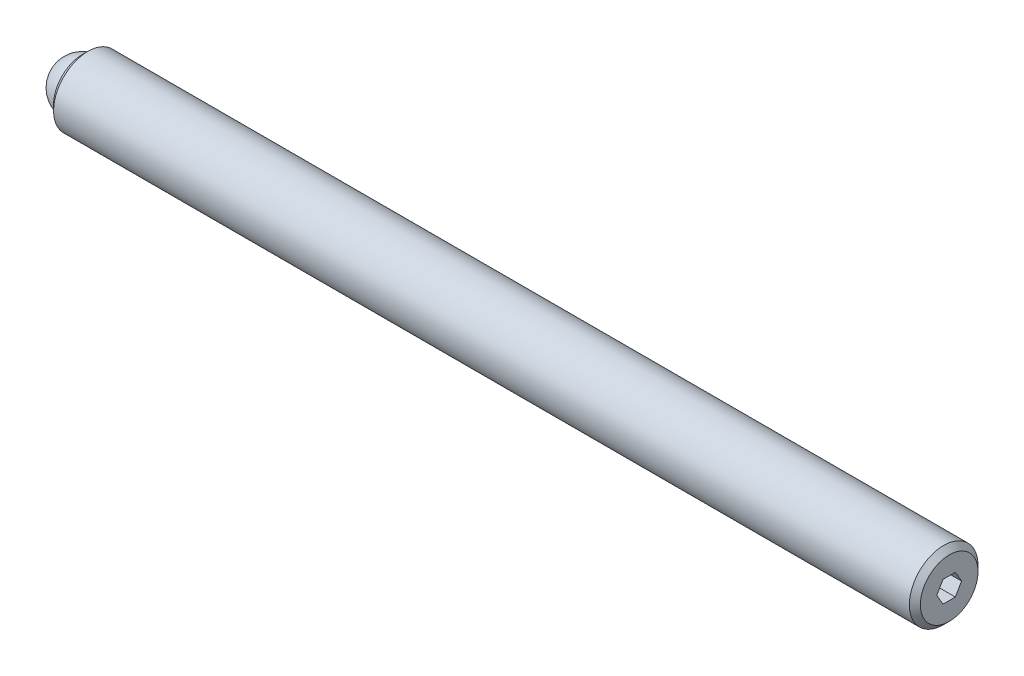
SolidWorks part; units mm, degrees
ref_plane "Front Plane" through (0, 0, 0) normal (0, 0, 1) x (1, 0, 0)
ref_plane "Top Plane" through (0, 0, 0) normal (0, 1, 0) x (1, 0, 0)
ref_plane "Right Plane" through (0, 0, 0) normal (1, 0, 0) x (0, 0, -1)
sketch "Sketch2" plane through (0, 0, 0) normal (1, 0, 0) x (0, 0, -1)
  circle A0 centre (0, 0) radius 3.175
  dimension "D1" = 6.35
extrude "Boss-Extrude1" add sketch "Sketch2" along normal blind 80.1688
sketch "Sketch3" plane through (0, 0, 0) normal (-1, 0, 0) x (0, 0, 1)
  circle A0 centre (0, 0) radius 2.3813
  dimension "D1" = 4.7625
chamfer "Chamfer1" distance 0.508 angle 45 1 edges at (0, 0, -3.175)
chamfer "Chamfer2" distance 0.508 angle 45 1 edges at (80.1688, 0, -3.175)
sketch "Sketch4" plane through (80.1688, 0, 0) normal (1, 0, 0) x (0, 0, -1)
  line L1 (1.1457, 0) -> (0.5728, 0.9922)
  line L2 (0.5728, 0.9922) -> (-0.5728, 0.9922)
  line L3 (-0.5728, 0.9922) -> (-1.1457, 0)
  line L4 (-1.1457, 0) -> (-0.5728, -0.9922)
  line L5 (-0.5728, -0.9922) -> (0.5728, -0.9922)
  line L6 (0.5728, -0.9922) -> (1.1457, 0)
  circle A0 centre (0, 0) radius 0.9922 construction
  dimension "D1" = 1.9844
extrude "Cut-Extrude2" cut sketch "Sketch4" against normal blind 2.286
extrude "Cut-Extrude3" cut sketch "Sketch3" against normal blind 1.9844
sketch "Sketch5" plane through (0, 0, 0) normal (-1, 0, 0) x (0, 0, 1)
  line L0 (0, 0) -> (0, -2.3813)
  line L1 (0, 0) -> (0, 2.3813)
  arc A0 (0, 2.3813) -> (0, -2.3813) centre (0, 0) ccw
  dimension "D1" = 2.3813
revolve "Revolve1" add sketch "Sketch5" angle 360 about L1
